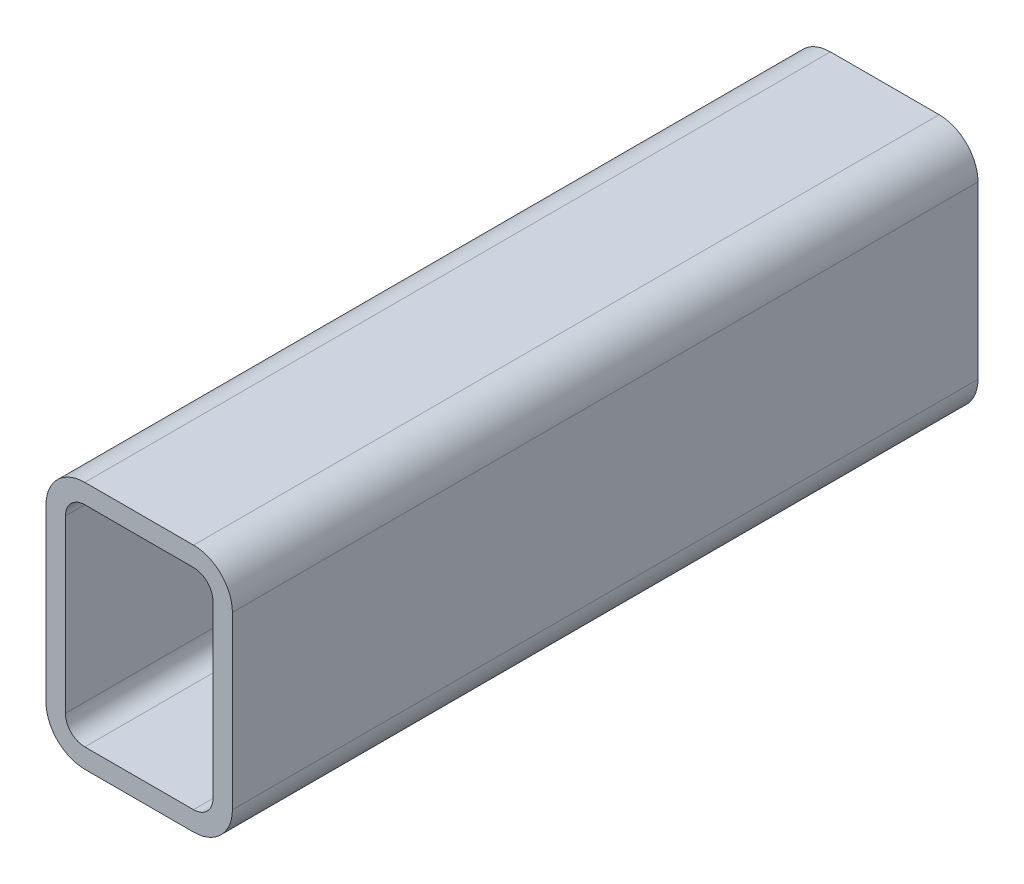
SolidWorks part; units mm, degrees
ref_plane "Front Plane" through (0, 0, 0) normal (0, 0, 1) x (1, 0, 0)
ref_plane "Top Plane" through (0, 0, 0) normal (0, 1, 0) x (1, 0, 0)
ref_plane "Right Plane" through (0, 0, 0) normal (1, 0, 0) x (0, 0, -1)
sketch "Sketch1" plane through (0, 0, 0) normal (0, 0, 1) x (1, 0, 0)
sketch_block_instance "HSS4x3x0.3125-1"
sketch_block "HSS4x3x0.3125"
extrude "Boss-Extrude1" add sketch "Sketch1" along normal blind 304.8
